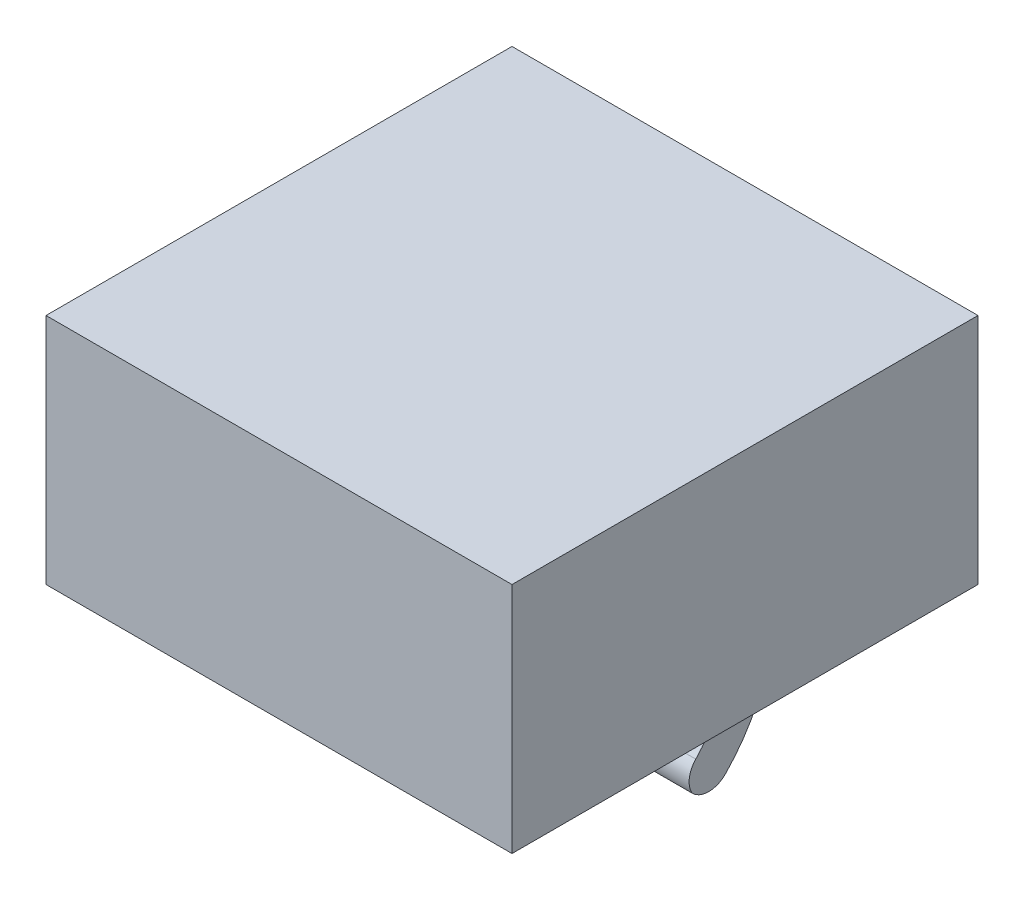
SolidWorks part; units mm, degrees
ref_plane "Front Plane" through (0, 0, 0) normal (0, 0, 1) x (1, 0, 0)
ref_plane "Top Plane" through (0, 0, 0) normal (0, 1, 0) x (1, 0, 0)
ref_plane "Right Plane" through (0, 0, 0) normal (1, 0, 0) x (0, 0, -1)
sketch "Sketch1" plane through (0, 0, 0) normal (1, 0, 0) x (0, 0, -1)
  line L5 (0, 0) -> (50.8, 0)
  line L6 (0, 0) -> (0, 25.4)
  line L7 (0, 25.4) -> (50.8, 25.4)
  line L8 (50.8, 0) -> (50.8, 25.4)
  dimension "D1" = 50.8
  dimension "D2" = 25.4
extrude "Boss-Extrude1" add sketch "Sketch1" along normal blind 50.8
sketch "Sketch2" plane through (0, 0, 0) normal (0, -1, 0) x (1, 0, 0)
  line L1 (3.6872, -4.2763) -> (46.3364, -4.2763)
  line L2 (3.6872, -4.2763) -> (3.6872, -21.1583)
  line L3 (3.6872, -21.1583) -> (46.3364, -21.1583)
  line L4 (46.3364, -4.2763) -> (46.3364, -21.1583)
extrude "Cut-Extrude1" cut sketch "Sketch2" against normal blind 11.176
sketch "Sketch3" plane through (0, 0, 0) normal (0, -1, 0) x (1, 0, 0)
  line L0 (50.8, 0) -> (50.8, -50.8) construction
  line L1 (12.7, -35.3773) -> (38.1, -35.3773)
  line L2 (12.7, -35.3773) -> (12.7, -45.0221)
  line L3 (12.7, -45.0221) -> (38.1, -45.0221)
  line L4 (38.1, -35.3773) -> (38.1, -45.0221)
  line L5 (0, 0) -> (0, -50.8) construction
  dimension "D1" = 12.7
  dimension "D2" = 12.7
extrude "Boss-Extrude2" add sketch "Sketch3" along normal blind 23.876
sketch "Sketch4" plane through (38.1, 0, 0) normal (1, 0, 0) x (0, 0, -1)
  line L0 (35.3773, 0) -> (35.3773, -7.3248)
  line L1 (35.3773, -23.876) -> (35.3773, 0) construction
  line L2 (31.075, -15.1407) -> (33.7296, -18.7573)
  line L3 (40.8595, -7.3248) -> (40.8595, 0)
  line L4 (45.0221, 0) -> (35.3773, 0) construction
  line L5 (40.8595, 0) -> (35.3773, 0)
  arc A0 (35.3773, -7.3248) -> (31.075, -15.1407) centre (26.1267, -7.3248) cw
  arc A1 (33.7296, -18.7573) -> (40.8595, -7.3248) centre (22.9816, -4.1147) ccw
extrude "Boss-Extrude3" add sketch "Sketch4" against normal blind 25.4 separate body
sketch "Sketch5" plane through (38.1, 0, 0) normal (1, 0, 0) x (0, 0, -1)
  line L0 (35.3773, -17.3914) -> (35.3773, -23.876)
  line L1 (35.3773, -23.876) -> (35.3773, 0) construction
  line L2 (35.3773, -23.876) -> (45.0221, -23.876)
  line L3 (45.0221, -23.876) -> (45.0221, 0)
  line L4 (45.0221, 0) -> (40.8595, 0)
  line L5 (40.8595, 0) -> (40.8595, -7.3248)
  arc A0 (33.7296, -18.7573) -> (40.8595, -7.3248) centre (22.9816, -4.1147) ccw construction
  arc A1 (40.8595, -7.3248) -> (35.3773, -17.3914) centre (28.8762, -7.3248) cw
extrude "Cut-Extrude2" cut sketch "Sketch5" against normal blind 25.4
fillet "Fillet1" radius 2.54 5 edges at (12.7, -3.6624, -40.8595) (38.1, -3.6624, -40.8595) (12.7, -13.0561, -39.4001) (25.4, -17.3914, -35.3773) (38.1, -13.0561, -39.4001)
fillet "Fillet2" radius 2.54 2 edges at (25.4, -18.7573, -33.7296) (25.4, -15.1407, -31.075)
